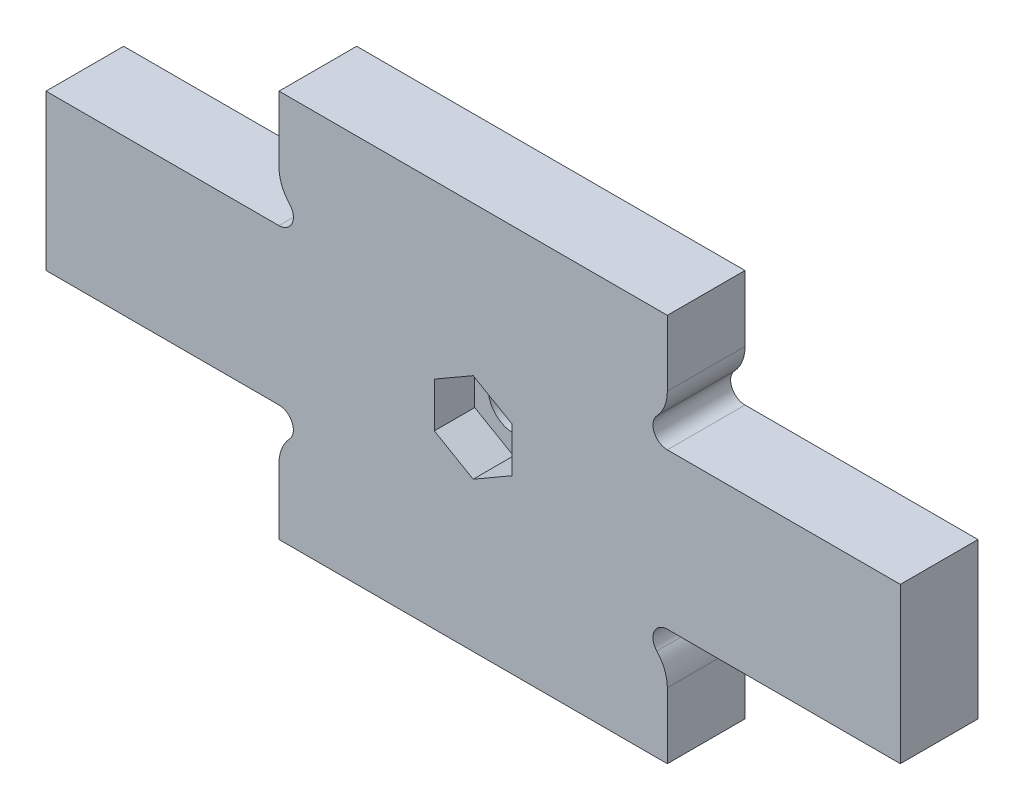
SolidWorks part; units mm, degrees
ref_plane "Plan de face" through (0, 0, 0) normal (0, 0, 1) x (1, 0, 0)
ref_plane "Plan de dessus" through (0, 0, 0) normal (0, 1, 0) x (1, 0, 0)
ref_plane "Plan de droite" through (0, 0, 0) normal (1, 0, 0) x (0, 0, -1)
sketch "Esquisse1" plane through (0, 0, 0) normal (0, 0, 1) x (1, 0, 0)
  line L7 (25, -10) -> (55, -10)
  line L8 (55, -10) -> (55, 10)
  line L9 (55, 10) -> (25, 10)
  line L10 (25, 16.5321) -> (25, 25)
  line L11 (25, 25) -> (-25, 25)
  line L12 (-25, 25) -> (-25, 16.5321)
  line L13 (-25, 10) -> (-55, 10)
  line L14 (-55, 10) -> (-55, -10)
  line L15 (-55, -10) -> (-25, -10)
  line L16 (-25, -16.5321) -> (-25, -25)
  line L17 (-25, -25) -> (25, -25)
  line L18 (25, -25) -> (25, -16.5321)
  arc A0 (25, -16.5321) -> (23.6496, -13.1145) centre (20, -16.5321) ccw
  arc A1 (25, -10) -> (23.6496, -13.1145) centre (25, -11.85) ccw
  arc A2 (23.6496, 13.1145) -> (25, 10) centre (25, 11.85) ccw
  arc A3 (23.6496, 13.1145) -> (25, 16.5321) centre (20, 16.5321) ccw
  arc A4 (-25, 16.5321) -> (-23.6496, 13.1145) centre (-20, 16.5321) ccw
  arc A5 (-25, 10) -> (-23.6496, 13.1145) centre (-25, 11.85) ccw
  arc A6 (-23.6496, -13.1145) -> (-25, -10) centre (-25, -11.85) ccw
  arc A7 (-23.6496, -13.1145) -> (-25, -16.5321) centre (-20, -16.5321) ccw
  dimension "D1" = 5
  dimension "D2" = 1.85
extrude "Boss.-Extru.1" add sketch "Esquisse1" along normal blind 10
sketch "Esquisse3" plane through (0, 0, 10) normal (0, 0, 1) x (1, 0, 0)
  circle A0 centre (0, 0) radius 3.25
  dimension "D1" = 6.5
extrude "Enlèv. mat.-Extru.1" cut sketch "Esquisse3" against normal through all
sketch "Esquisse4" plane through (0, 0, 10) normal (0, 0, 1) x (1, 0, 0)
  line L1 (5, -2.8868) -> (5, 2.8868)
  line L2 (5, 2.8868) -> (0, 5.7735)
  line L3 (0, 5.7735) -> (-5, 2.8868)
  line L4 (-5, 2.8868) -> (-5, -2.8868)
  line L5 (-5, -2.8868) -> (0, -5.7735)
  line L6 (0, -5.7735) -> (5, -2.8868)
  circle A0 centre (0, 0) radius 5 construction
  dimension "D1" = 10
extrude "Enlèv. mat.-Extru.3" cut sketch "Esquisse4" against normal blind 5.2
